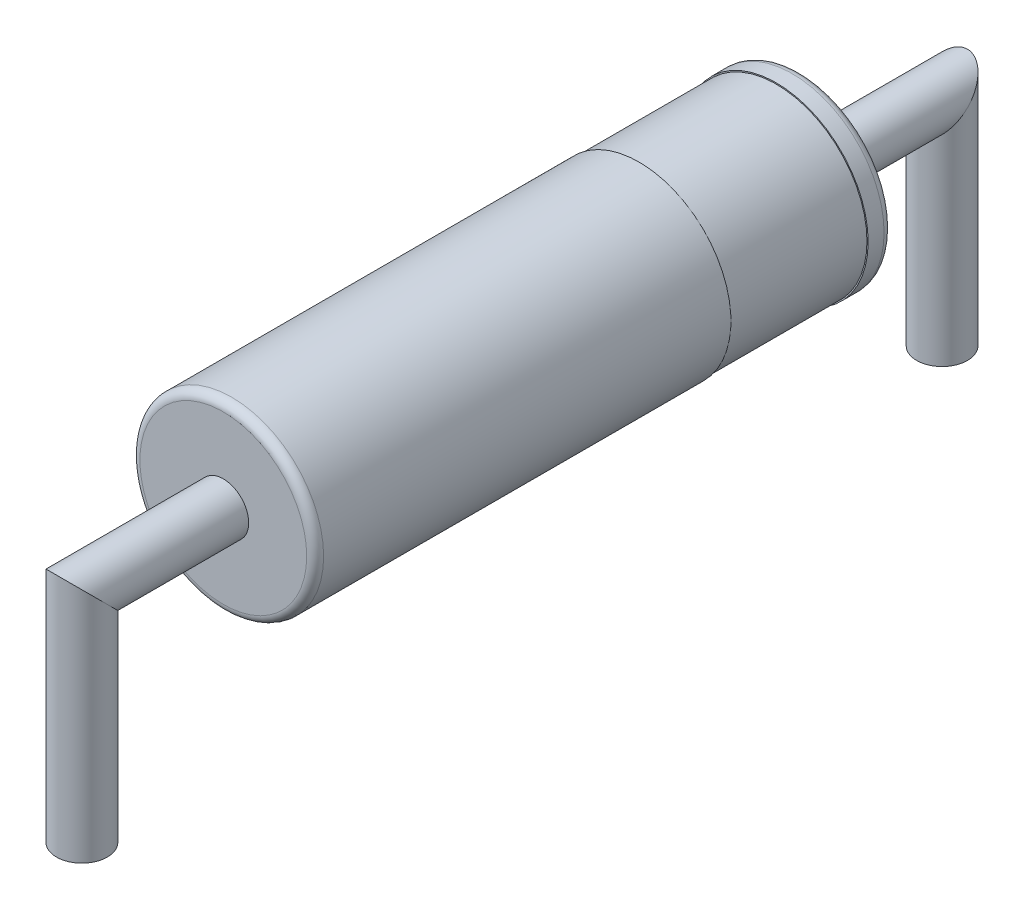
SolidWorks part; units mm, degrees
ref_plane "Plan de face" through (0, 0, 0) normal (0, 0, 1) x (1, 0, 0)
ref_plane "Plan de dessus" through (0, 0, 0) normal (0, 1, 0) x (1, 0, 0)
ref_plane "Plan de droite" through (0, 0, 0) normal (1, 0, 0) x (0, 0, -1)
sketch "Esquisse1" plane through (0, 0, 0) normal (0, 0, 1) x (1, 0, 0)
  circle A0 centre (0, 0) radius 1.085
  dimension "D1" = 2.17
extrude "Extrusion1" add sketch "Esquisse1" along normal mid plane 6.82
fillet "Congé1" radius 0.1 2 edges at (1.085, 0, 3.41) (1.085, 0, -3.41)
sketch "Esquisse2" plane through (0, 0, -3.41) normal (0, 0, -1) x (-1, 0, 0)
  circle A0 centre (0, 0) radius 0.3
sketch "Esquisse3" plane through (0, 0, 0) normal (1, 0, 0) x (0, 0, -1)
  line L0 (3.41, 0) -> (5.08, 0)
  line L1 (3.41, -0.3) -> (3.41, 0.3) construction
  line L2 (0, 3.3062) -> (0, -4.9544) construction
  line L3 (-8.8413, 0) -> (13.4938, 0) construction
  line L4 (5.08, 2.5036) -> (5.08, -4.9544) construction
  line L5 (-9.9571, -2.585) -> (11.2035, -2.585) construction
  line L6 (7.7975, -1.085) -> (4.1565, -1.085) construction
  line L7 (5.08, 0) -> (5.08, -2.585)
  dimension "D1" = 5.08
  dimension "D2" = 1.5
sweep "Balayage1" add profiles "Esquisse2" path "Esquisse3"
mirror "Symétrie1" about plane through (0, 0, 0) normal (0, 0, 1) of "Balayage1"
sketch "Esquisse4" plane through (0, 0, 0) normal (1, 0, 0) x (0, 0, -1)
  line L0 (0, 0) -> (3.1219, 0) construction
  line L3 (3.1219, 1.1535) -> (1.5008, 1.1535)
  line L4 (3.1219, 1.1535) -> (3.1219, 1.0709)
  line L5 (3.1219, 1.0709) -> (1.5008, 1.0709)
  line L6 (1.5008, 1.1535) -> (1.5008, 1.0709)
revolve "Enlèvement de matière-Révolution1" cut sketch "Esquisse4" angle 360 about L0
